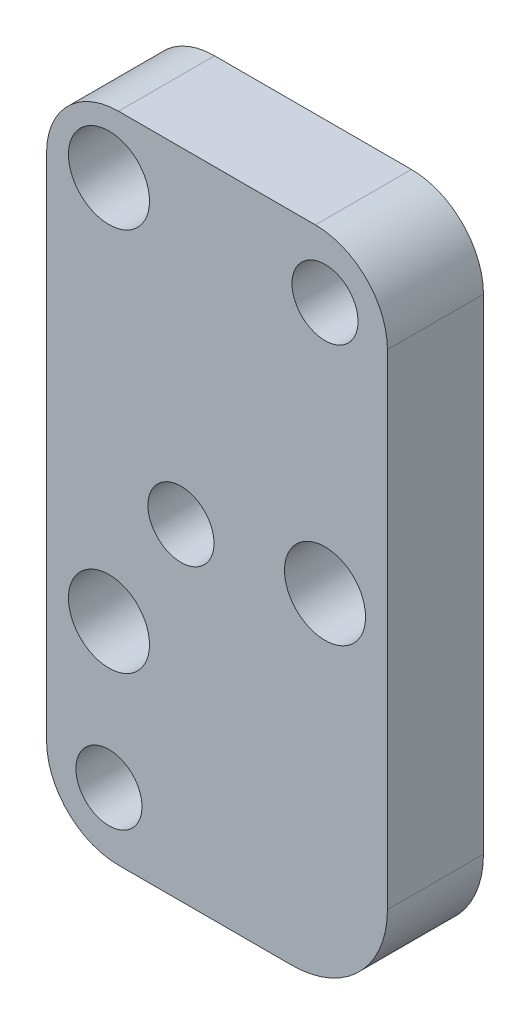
SolidWorks part; units mm, degrees
ref_plane "Front" through (0, 0, 0) normal (0, 0, 1) x (1, 0, 0)
ref_plane "Top" through (0, 0, 0) normal (0, 1, 0) x (1, 0, 0)
ref_plane "Right" through (0, 0, 0) normal (1, 0, 0) x (0, 0, -1)
ref_plane "Plane1"
sketch "Sketch1" plane through (0, 0, 71.9582) normal (0, 0, -1) x (-1, 0, 0)
  line L4 (111.125, 77.8002) -> (111.125, 13.6652)
  line L5 (147.955, 88.5952) -> (121.92, 88.5952)
  line L6 (158.75, 10.4902) -> (158.75, 77.8002)
  line L7 (125.095, -0.3048) -> (147.955, -0.3048)
  line L8 (111.125, 77.8002) -> (111.125, 13.6652) construction
  line L9 (147.955, 88.5952) -> (121.92, 88.5952) construction
  line L10 (158.75, 10.4902) -> (158.75, 77.8002) construction
  line L11 (125.095, -0.3048) -> (147.955, -0.3048) construction
  line L12 (147.955, 87.3252) -> (121.92, 87.3252)
  line L13 (112.395, 77.8002) -> (112.395, 13.6652)
  line L34 (125.095, 0.9652) -> (147.955, 0.9652)
  line L56 (157.48, 10.4902) -> (157.48, 77.8002)
  arc A4 (121.92, 88.5952) -> (111.125, 77.8002) centre (121.92, 77.8002) ccw
  arc A5 (158.75, 77.8002) -> (147.955, 88.5952) centre (147.955, 77.8002) ccw
  arc A6 (147.955, -0.3048) -> (158.75, 10.4902) centre (147.955, 10.4902) ccw
  arc A7 (111.125, 13.6652) -> (125.095, -0.3048) centre (125.095, 13.6652) ccw
  arc A8 (121.92, 88.5952) -> (111.125, 77.8002) centre (121.92, 77.8002) ccw construction
  arc A10 (147.955, -0.3048) -> (158.75, 10.4902) centre (147.955, 10.4902) ccw construction
  arc A11 (111.125, 13.6652) -> (125.095, -0.3048) centre (125.095, 13.6652) ccw construction
  arc A12 (121.92, 87.3252) -> (112.395, 77.8002) centre (121.92, 77.8002) ccw
  arc A13 (112.395, 13.6652) -> (125.095, 0.9652) centre (125.095, 13.6652) ccw
  arc A34 (147.955, 0.9652) -> (157.48, 10.4902) centre (147.955, 10.4902) ccw
  arc A35 (158.75, 77.8002) -> (147.955, 88.5952) centre (147.955, 77.8002) ccw construction
  arc A36 (157.48, 77.8002) -> (147.955, 87.3252) centre (147.955, 77.8002) ccw
extrude "Boss-Extrude1" add sketch "Sketch1" against normal blind 12.7 flip side to cut
hole_wizard "Hole12" positions "Point_Sketch2" profile "Profil_Sketch2" counterbore size "1/4" standard "ANSI Inch"
sketch "Point_Sketch2" plane through (-139.2341, 54.3512, 84.6582) normal (0, 0, -1) x (1, 0, 0)
  point P0 (-9.9909, 26.081)
  point P2 (18.5841, 8.6185)
  point P4 (-9.9909, -24.719)
sketch "Profil_Sketch2" plane through (-149.225, 28.2702, 84.6582) normal (1, 0, 0) x (0, -1, 0)
  line L0 (0, 0) -> (0, 12.7)
  line L1 (0, 12.7) -> (3.5687, 12.7)
  line L3 (3.5687, 12.7) -> (3.5687, 7.874)
  line L4 (3.5687, 7.874) -> (5.3594, 7.874)
  line L5 (5.3594, 7.874) -> (5.3594, 0)
  line L7 (5.3594, 0) -> (0, 0)
  line L11 (0, -6.35) -> (0, 107.95) construction
  dimension "Diameter" = 7.1374
  dimension "Thru Hole Depth" = 12.7
  dimension "L1" = 7.874
other "usin_LS160_.25-20x.625-SHCS<1>"
hole_wizard "Hole1" positions "Point_Sketch" profile "Profil_Sketch" hole size "Ø0.15" standard "ISO"
sketch "Point_Sketch" plane through (-116.9957, 89.6713, 71.9582) normal (0, 0, 1) x (-1, 0, 0)
  point P0 (3.6543, 10.6011)
  point P2 (22.7043, 45.5261)
  point P4 (32.2293, 80.4511)
sketch "Profil_Sketch" plane through (-120.65, 79.0702, 71.9582) normal (1, 0, 0) x (0, 1, 0)
  line L0 (0, 0) -> (0, 12.7)
  line L1 (0, 12.7) -> (4.3688, 12.7)
  line L2 (4.3688, 12.7) -> (4.3688, 0)
  line L5 (4.3688, 0) -> (0, 0)
  line L11 (0, -6.35) -> (0, 107.95) construction
  dimension "Diameter" = 8.7376
  dimension "Thru Hole Depth" = 12.7
other "usin_DL090_.3125-18x2-SHCS<1>"
